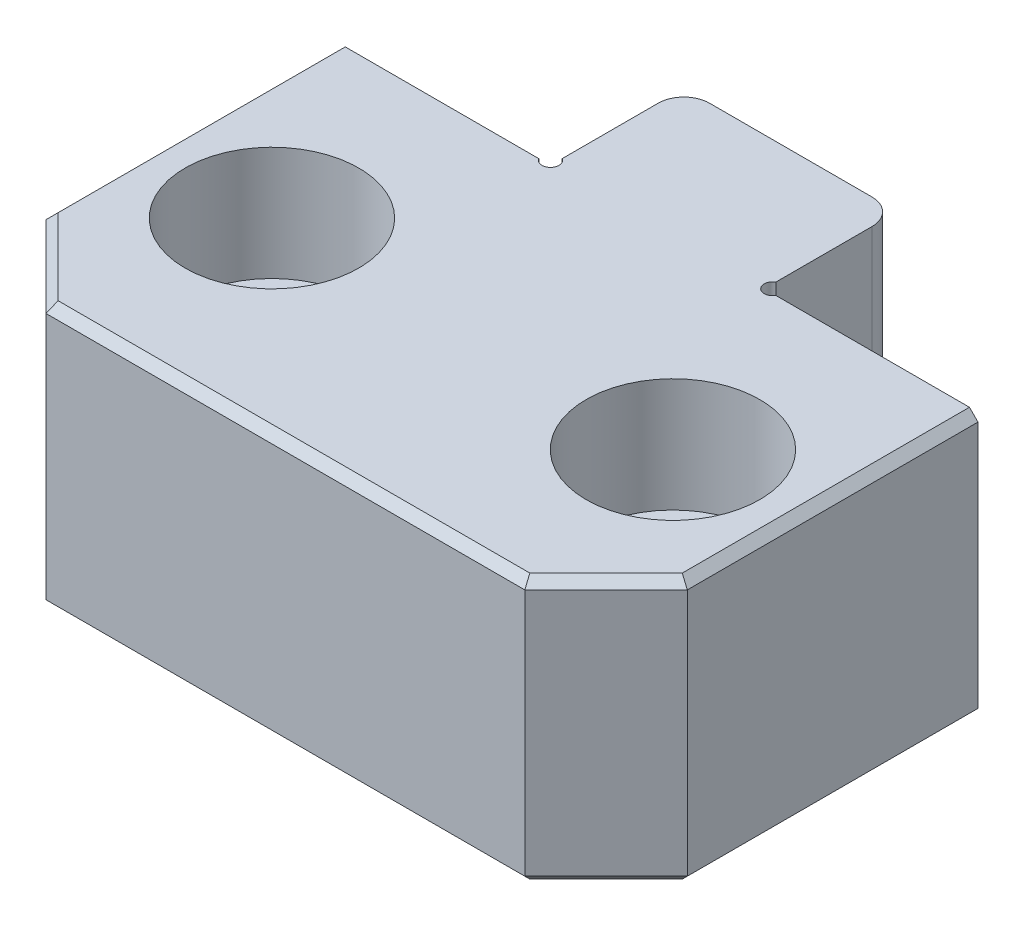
SolidWorks part; units mm, degrees
ref_plane "Front Plane" through (0, 0, 0) normal (0, 0, 1) x (1, 0, 0)
ref_plane "Top Plane" through (0, 0, 0) normal (0, 1, 0) x (1, 0, 0)
ref_plane "Right Plane" through (0, 0, 0) normal (1, 0, 0) x (0, 0, -1)
sketch "Sketch2" plane through (0, 0, 0) normal (0, 1, 0) x (1, 0, 0)
  line L0 (-6.35, 0.6939) -> (-6.35, 7.9248)
  line L1 (-19.05, -22.098) -> (19.05, -22.098)
  line L2 (-19.05, -22.098) -> (-19.05, 0)
  line L3 (-19.05, 0) -> (-7.0439, 0)
  line L4 (19.05, -22.098) -> (19.05, 0)
  line L5 (-6.35, 7.9248) -> (6.35, 7.9248)
  line L6 (6.35, 7.9248) -> (6.35, 0.6939)
  line L7 (7.0439, 0) -> (19.05, 0)
  line L8 (0, -55) -> (0, 55) construction
  line L9 (-55, 0) -> (55, 0) construction
  arc A0 (6.35, 0.6939) -> (7.0439, 0) centre (6.604, 0.254) ccw
  arc A2 (-7.0439, 0) -> (-6.35, 0.6939) centre (-6.604, 0.254) ccw
  dimension "D8" = 0.254
  dimension "D12" = 1.016
  dimension "D13" = 0.254
  dimension "D14" = 1.016
  dimension "D1" = 38.1
  dimension "D3" = 19.05
  dimension "D4" = 22.098
  dimension "D5" = 7.9248
  dimension "D6" = 6.35
  dimension "D7" = 12.7
  dimension "D10" = 0.254
  dimension "D11" = 0.254
extrude "Extrude1" add sketch "Sketch2" along normal blind 15.748
chamfer "Chamfer1" distance 4.826 angle 45 2 edges at (19.05, 7.874, 22.098) (-19.05, 7.874, 22.098)
sketch "Sketch4" plane through (0, 0, 0) normal (0, -1, 0) x (1, 0, 0)
  line L5 (-14.224, 22.098) -> (14.224, 22.098) construction
  line L6 (-19.05, 0) -> (-19.05, 17.272) construction
  line L7 (19.05, 17.272) -> (19.05, 0) construction
  circle A0 centre (11.9126, 10.9855) radius 3.5687
  circle A1 centre (-11.9126, 10.9855) radius 3.5687
  dimension "D5" = 7.1374
  dimension "D6" = 7.1374
  dimension "D1" = 11.1125
  dimension "D2" = 7.1374
  dimension "D3" = 7.1374
  dimension "D4" = 11.1125
extrude "Cut-Extrude2" cut sketch "Sketch4" against normal blind 15.748
sketch "Sketch5" plane through (0, 0, 0) normal (0, -1, 0) x (1, 0, 0)
  circle A1 centre (11.9126, 10.9855) radius 5.1562
  circle A3 centre (-11.9126, 10.9855) radius 5.1562
  dimension "D1" = 10.3124
  dimension "D2" = 10.3124
fillet "Fillet2" radius 1.524 2 edges at (-6.35, 7.874, -7.9248) (6.35, 7.874, -7.9248)
chamfer "Chamfer3" distance 0.508 angle 45 10 edges at (-19.05, 15.748, 8.636) (-16.637, 15.748, 19.685) (19.05, 15.748, 8.636) (16.637, 15.748, 19.685) (0, 15.748, 22.098) (-19.05, 0, 8.636) (-16.637, 0, 19.685) (0, 0, 22.098) (16.637, 0, 19.685) (19.05, 0, 8.636)
extrude "Cut-Extrude4" cut sketch "Sketch5" along normal blind 6.7564 from surface at -15.748
sketch "Sketch6" plane through (0, 0, 0) normal (0, -1, 0) x (1, 0, 0)
  line L0 (-7.0439, 0) -> (-18.542, 0) construction
  line L1 (6.35, 0) -> (-6.35, 0)
  line L2 (4.826, -7.9248) -> (-4.826, -7.9248) construction
  line L3 (6.35, -7.9248) -> (-6.35, -7.9248)
  line L4 (6.35, -0.6939) -> (6.35, -6.4008) construction
  line L5 (6.35, 0) -> (6.35, -7.9248)
  line L6 (-6.35, -6.4008) -> (-6.35, -0.6939) construction
  line L7 (-6.35, -7.9248) -> (-6.35, 0)
extrude "Extrude2" cut sketch "Sketch6" against normal blind 0.254
